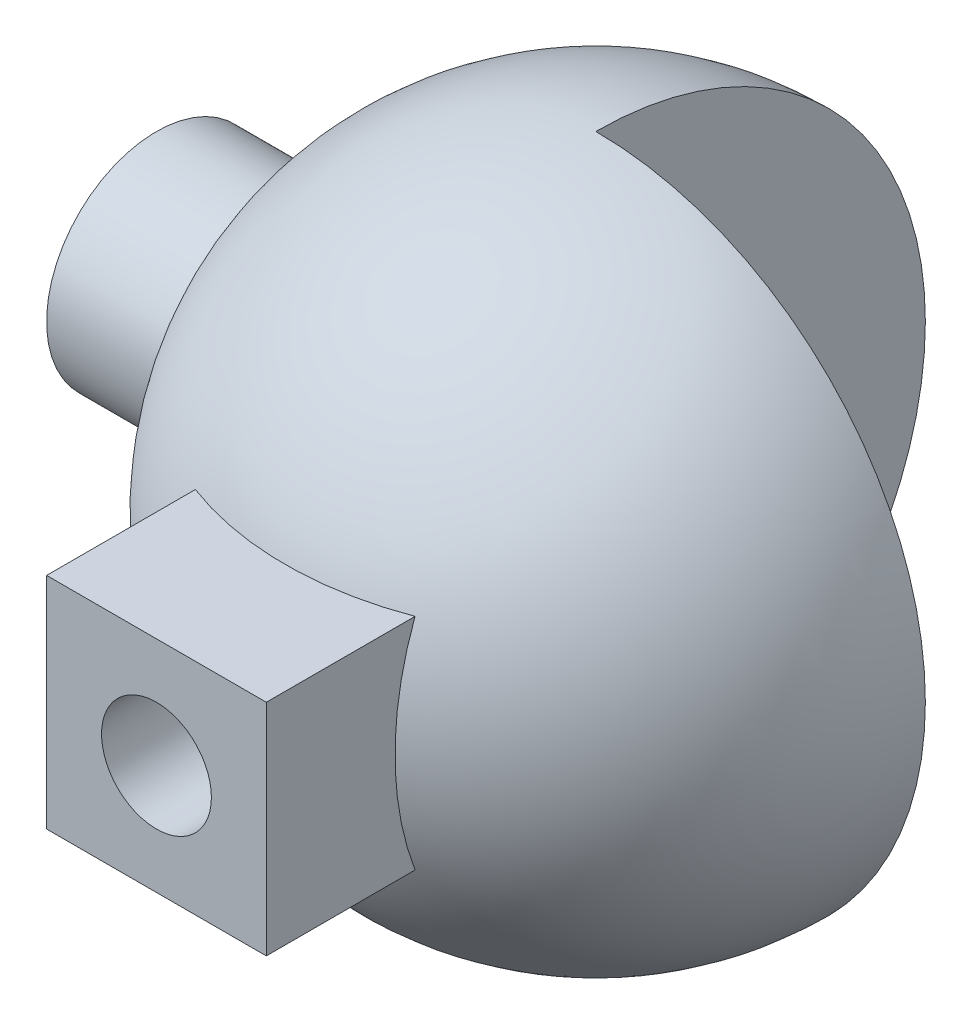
SolidWorks part; units mm, degrees
ref_plane "正面" through (0, 0, 0) normal (0, 0, 1) x (1, 0, 0)
ref_plane "平面" through (0, 0, 0) normal (0, 1, 0) x (1, 0, 0)
ref_plane "右側面" through (0, 0, 0) normal (1, 0, 0) x (0, 0, -1)
sketch "ｽｹｯﾁ1" plane through (0, 0, 0) normal (0, 0, 1) x (1, 0, 0)
  line L0 (0, 30) -> (0, -30)
  arc A0 (0, -30) -> (0, 30) centre (0, 0) ccw
  dimension "D1" = 60
revolve "回転1" add sketch "ｽｹｯﾁ1" angle 270 about L0
sketch "ｽｹｯﾁ2" plane through (0, 0, 0) normal (0, 0, 1) x (1, 0, 0)
  line L1 (-10, 10) -> (10, 10)
  line L2 (-10, 10) -> (-10, -10)
  line L3 (-10, -10) -> (10, -10)
  line L4 (10, 10) -> (10, -10)
  point P4 (0, 10)
  point P6 (-10, 0)
  dimension "D1" = 20
  dimension "D2" = 20
extrude "押し出し1" add sketch "ｽｹｯﾁ2" along normal blind 40
sketch "ｽｹｯﾁ3" plane through (0, 0, 40) normal (0, 0, 1) x (1, 0, 0)
  circle A0 centre (0, 0) radius 5
  dimension "D1" = 10
extrude "ｶｯﾄ - 押し出し1" cut sketch "ｽｹｯﾁ3" against normal up to surface (40 mm away)
sketch "ｽｹｯﾁ5" plane through (0, 0, 0) normal (1, 0, 0) x (0, 0, -1)
  circle A0 centre (0, 0) radius 10
  dimension "D1" = 20
extrude "押し出し2" add sketch "ｽｹｯﾁ5" against normal blind 40
sketch "ｽｹｯﾁ6" plane through (-40, 0, 0) normal (-1, 0, 0) x (0, 0, 1)
  line L1 (-5, 5) -> (5, 5)
  line L2 (-5, 5) -> (-5, -5)
  line L3 (-5, -5) -> (5, -5)
  line L4 (5, 5) -> (5, -5)
  point P5 (0, 5)
  point P7 (-5, 0)
  dimension "D1" = 10
  dimension "D2" = 10
extrude "ｶｯﾄ - 押し出し2" cut sketch "ｽｹｯﾁ6" against normal up to surface (40 mm away)
